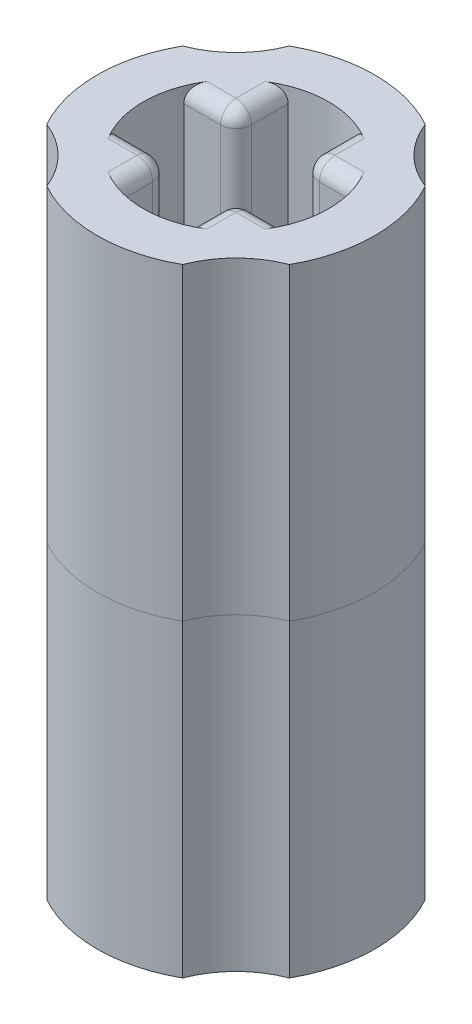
SolidWorks part; units mm, degrees
ref_plane "정면" through (0, 0, 0) normal (0, 0, 1) x (1, 0, 0)
ref_plane "윗면" through (0, 0, 0) normal (0, 1, 0) x (1, 0, 0)
ref_plane "우측면" through (0, 0, 0) normal (1, 0, 0) x (0, 0, -1)
imported_body "3713 Bush-1-solid1"
imported_body "3713 Bush-2-solid1"
sketch "스케치1" plane through (0, 0, 0) normal (1, 0, 0) x (0, 0, -1)
  line L0 (0, 12.498) -> (0, -5.1262) construction
  line L4 (-3.6, -4) -> (3.6, -4) construction
  line L5 (-3.6, -4) -> (-3.6, 2.4)
  line L7 (-3.6, -4) -> (-2.4, -4)
  line L11 (-3.6, 2.4) -> (-2.4, 2.4)
  line L13 (-3.6, 2.4) -> (-3.141, 2.4) construction
  line L15 (-2.4, 2.4) -> (-2.4, -4)
  dimension "D1" = 2.4
revolve "회전1" add sketch "스케치1" angle 360 about L0
ref_plane "평면1" through (0, 4, 0) normal (0, 1, 0) x (1, 0, 0)
sketch "스케치3" plane through (0, 0, 0) normal (1, 0, 0) x (0, 0, -1)
  line L0 (0, 0) -> (0, 12.4281) construction
  line L1 (-3.6, 12) -> (-2.4, 12)
  line L3 (3.6, 12) -> (-3.6, 12) construction
  line L4 (-3.6, 12) -> (-3.6, 5.6)
  line L5 (-2.4, 12) -> (-2.4, 5.6)
  line L6 (-1.759, 5.6) -> (-3.141, 5.6) construction
  line L7 (-2.4, 5.6) -> (-3.6, 5.6)
  dimension "D1" = 2.4
revolve "회전2" add sketch "스케치3" angle 360 about L0
sketch "스케치2" plane through (0, 4, 0) normal (0, 1, 0) x (1, 0, 0)
  arc A0 (-3.141, 1.759) -> (-1.759, 3.141) centre (-4, 4) ccw
  arc A1 (-1.759, 3.141) -> (-3.141, 1.759) centre (0, 0) ccw
  arc A2 (1.759, 3.141) -> (3.141, 1.759) centre (4, 4) ccw
  arc A3 (3.141, 1.759) -> (1.759, 3.141) centre (0, 0) ccw
  arc A4 (3.141, -1.759) -> (1.759, -3.141) centre (4, -4) ccw
  arc A5 (1.759, -3.141) -> (3.141, -1.759) centre (0, 0) ccw
  arc A6 (-1.759, -3.141) -> (-3.141, -1.759) centre (-4, -4) ccw
  arc A7 (-3.141, -1.759) -> (-1.759, -3.141) centre (0, 0) ccw
  point P18 (0, 0)
  dimension "D1" = 2.4
  dimension "D2" = 3.6
  dimension "D3" = 4
extrude "컷-돌출2" cut sketch "스케치2" against normal through all both and the other way through all
